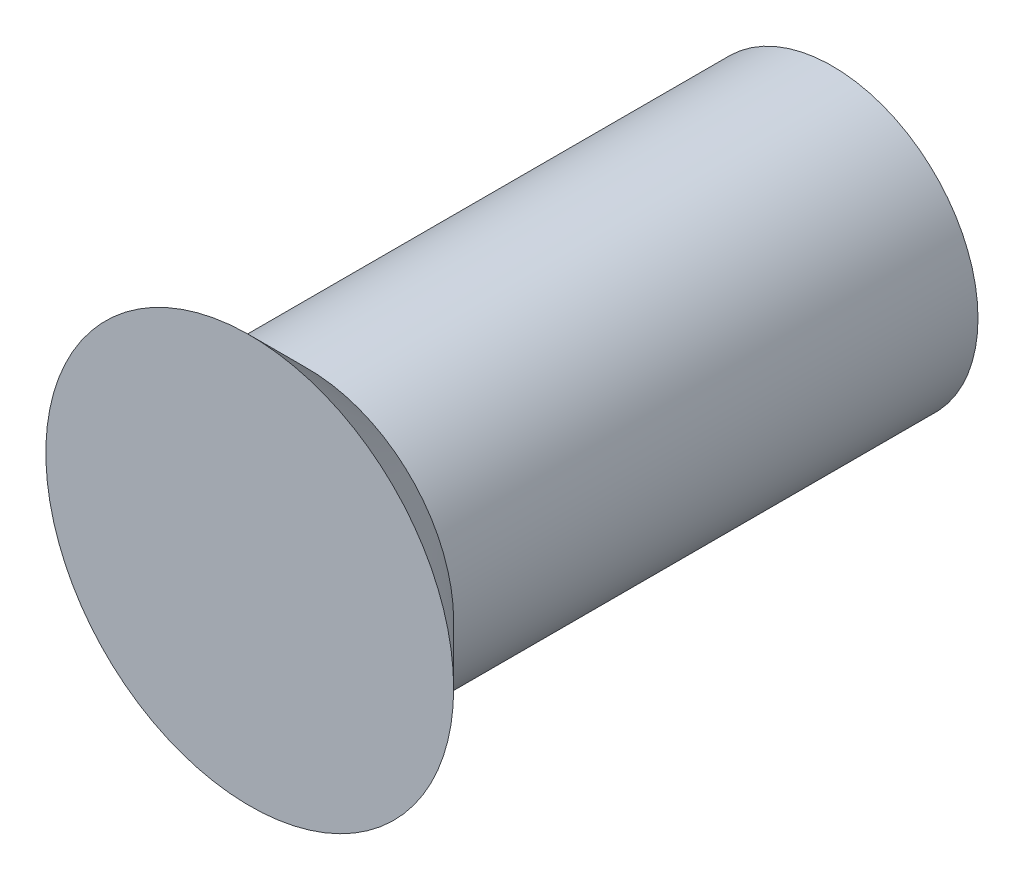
SolidWorks part; units mm, degrees
ref_plane "Ön Düzlem" through (0, 0, 0) normal (0, 0, 1) x (1, 0, 0)
ref_plane "Üst Düzlem" through (0, 0, 0) normal (0, 1, 0) x (1, 0, 0)
ref_plane "Sağ Düzlem" through (0, 0, 0) normal (1, 0, 0) x (0, 0, -1)
sketch "Çizim1" plane through (0, 0, 0) normal (0, 0, 1) x (1, 0, 0)
  circle A0 centre (0, 0) radius 2.5
  dimension "D1" = 5
extrude "Yükseklik-Ekstrüzyon1" add sketch "Çizim1" along normal blind 9
sketch "Çizim2" plane through (0, 0, 9) normal (0, 0, 1) x (1, 0, 0)
  circle A0 centre (0, 0) radius 2.5
extrude "Yükseklik-Ekstrüzyon2" add sketch "Çizim2" along normal blind 1 draft 45
